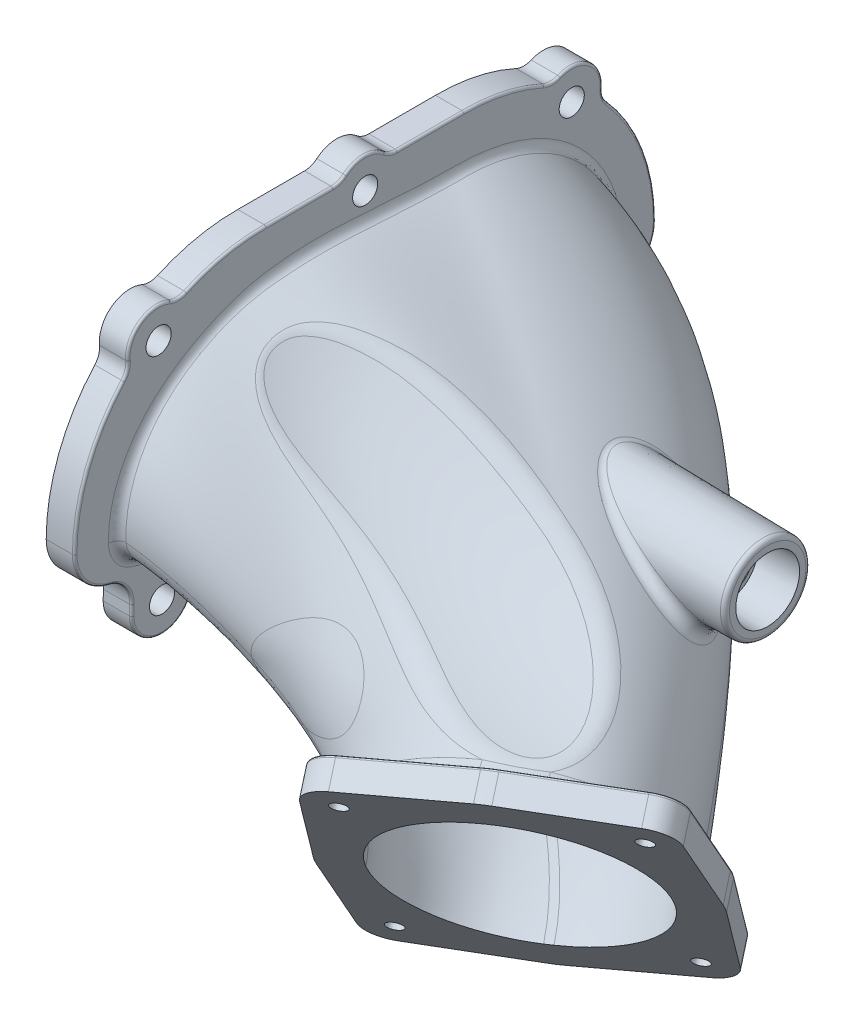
SolidWorks part; units mm, degrees
ref_plane "Front" through (0, 0, 0) normal (0, 0, 1) x (1, 0, 0)
ref_plane "Top" through (0, 0, 0) normal (0, 1, 0) x (1, 0, 0)
ref_plane "Right" through (0, 0, 0) normal (1, 0, 0) x (0, 0, -1)
imported_body "Surface-Imported1"
imported_body "Surface-Imported2"
surface "Surface-Fill1"
other "DeleteFace1"
surface "Surface-Fill2"
surface "Surface-Knit1"
surface "Surface-Knit2"
surface "Surface-Knit3"
sketch3d "3DSketch1"
  spline S2 degree 5 poles (45.3569, 8.3659, 73.7516) (48.2722, 5.6561, 72.8727) (51.2567, 3.0122, 72.0835) (54.6136, -0.4735, 71.1629) (57.1363, -3.4933, 70.6416) (59.7605, -6.4268, 70.2516) knots 0 0 0 0 0 0 1 1 1 1 1 1
  spline S3 degree 3 poles (59.7605, -6.4268, 70.2516) (59.9657, -6.6561, 70.2211) (60.3463, -7.0829, 70.1668) (61.4381, -8.3146, 70.0238) (62.3711, -9.3814, 69.9287) (63.4037, -10.5747, 69.8533) (64.2826, -11.5954, 69.8011) (65.1945, -12.6667, 69.7792) (66.0567, -13.6877, 69.785) (66.6951, -14.4472, 69.8007) (67.4781, -15.3849, 69.8429) (68.2004, -16.2559, 69.9056) (69.2522, -17.5307, 70.0264) (70.0361, -18.4897, 70.1603) (70.6344, -19.2262, 70.2919) (70.6412, -19.2346, 70.2934) (70.643, -19.2368, 70.2938) knots 0 0 0 0 0.051541 0.096019 0.277635 0.293332 0.368443 0.511466 0.541093 0.606815 0.689749 0.763246 0.81539 0.997894 0.99945 1 1 1 1 construction
  spline S4 degree 3 poles (12.2454, 29.58, 82.7208) (12.5807, 29.4833, 82.6701) (13.1863, 29.3007, 82.5747) (13.8234, 29.0936, 82.4673) (14.6346, 28.8207, 82.3263) (16.0018, 28.3328, 82.0757) (17.8666, 27.5762, 81.6934) (19.4615, 26.8543, 81.3354) (20.2636, 26.4705, 81.1471) (20.9854, 26.1186, 80.9752) (21.8749, 25.6708, 80.7579) (23.1564, 24.9904, 80.432) (24.3563, 24.3219, 80.1159) (25.6267, 23.5834, 79.7713) (26.7894, 22.8779, 79.4467) (27.7441, 22.2764, 79.174) (28.7581, 21.6238, 78.8806) (29.5952, 21.0683, 78.6342) (30.7943, 20.2501, 78.2762) (31.8386, 19.5185, 77.9603) (32.7966, 18.8242, 77.6664) (33.5944, 18.2369, 77.4203) (34.7955, 17.3395, 77.0478) (35.9814, 16.4186, 76.6759) (37.2085, 15.4406, 76.2897) (38.0314, 14.7755, 76.0303) (38.9002, 14.0573, 75.7563) (39.8386, 13.2708, 75.4605) (41.1103, 12.1879, 75.0604) (42.4743, 10.9893, 74.6345) (43.3965, 10.1604, 74.3498) (44.0427, 9.5763, 74.1509) (44.5256, 9.135, 74.0033) (45.092, 8.6118, 73.8316) (45.2437, 8.4712, 73.7858) (45.3569, 8.3659, 73.7516) knots 0 0 0 0 0.029834 0.05385 0.056603 0.101882 0.175202 0.221964 0.243312 0.246361 0.286007 0.322264 0.360216 0.392746 0.435442 0.46399 0.478137 0.526255 0.539131 0.586028 0.620456 0.625878 0.658408 0.729652 0.734311 0.771161 0.80547 0.814746 0.858331 0.924069 0.94308 0.945756 0.985454 0.989129 1 1 1 1 construction
surface "Surface-Fill5"
surface "Surface-Fill6"
surface "Surface-Knit4"
surface "Surface-Knit5"
